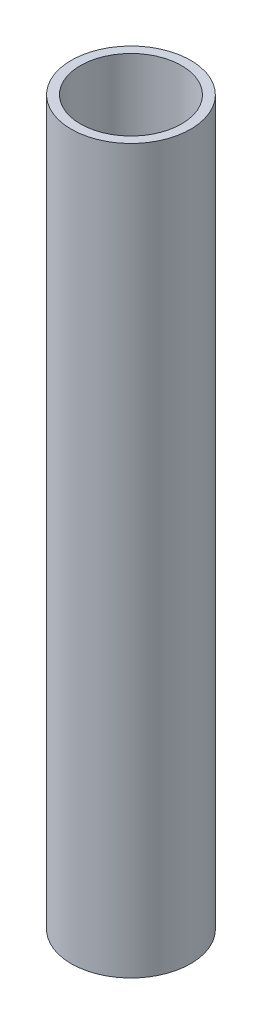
SolidWorks part; units mm, degrees
ref_plane "Front Plane" through (0, 0, 0) normal (0, 0, 1) x (1, 0, 0)
ref_plane "Top Plane" through (0, 0, 0) normal (0, 1, 0) x (1, 0, 0)
ref_plane "Right Plane" through (0, 0, 0) normal (1, 0, 0) x (0, 0, -1)
sketch "Sketch1" plane through (0, 0, 0) normal (0, 1, 0) x (1, 0, 0)
  circle A0 centre (0, 0) radius 24.13
  circle A1 centre (0, 0) radius 20.447
  dimension "D1" = 48.26
  dimension "D2" = 3.683
extrude "Extrude1" add sketch "Sketch1" along normal mid plane 292.1
